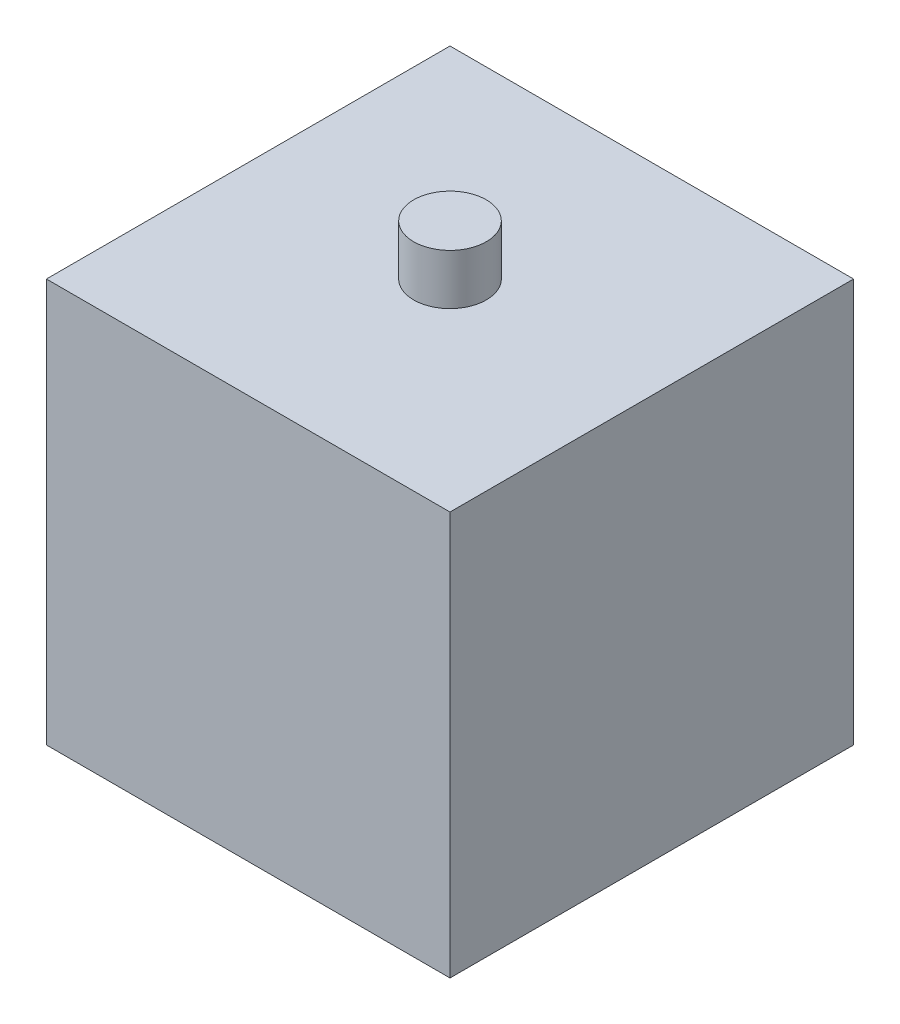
SolidWorks part; units mm, degrees
ref_plane "Front XY" through (0, 0, 0) normal (0, 0, 1) x (1, 0, 0)
ref_plane "Top XZ" through (0, 0, 0) normal (0, 1, 0) x (1, 0, 0)
ref_plane "Right YZ" through (0, 0, 0) normal (1, 0, 0) x (0, 0, -1)
sketch "Sketch1" plane through (0, 0, 0) normal (0, 1, 0) x (1, 0, 0)
  line L1 (-12.7, 12.7) -> (12.7, 12.7)
  line L2 (-12.7, 12.7) -> (-12.7, -12.7)
  line L3 (-12.7, -12.7) -> (12.7, -12.7)
  line L4 (12.7, 12.7) -> (12.7, -12.7)
  line L5 (-12.7, 12.7) -> (12.7, -12.7) construction
  line L6 (-12.7, -12.7) -> (12.7, 12.7) construction
  point P0 (0, 0)
  dimension "D1" = 25.4
extrude "Extrude1" add sketch "Sketch1" along normal blind 25.4
sketch "Sketch2" plane through (0, 25.4, 0) normal (0, 1, 0) x (1, 0, 0)
  circle A0 centre (0, 0) radius 2.286
  dimension "D1" = 4.572
extrude "Extrude2" add sketch "Sketch2" along normal blind 3.175
